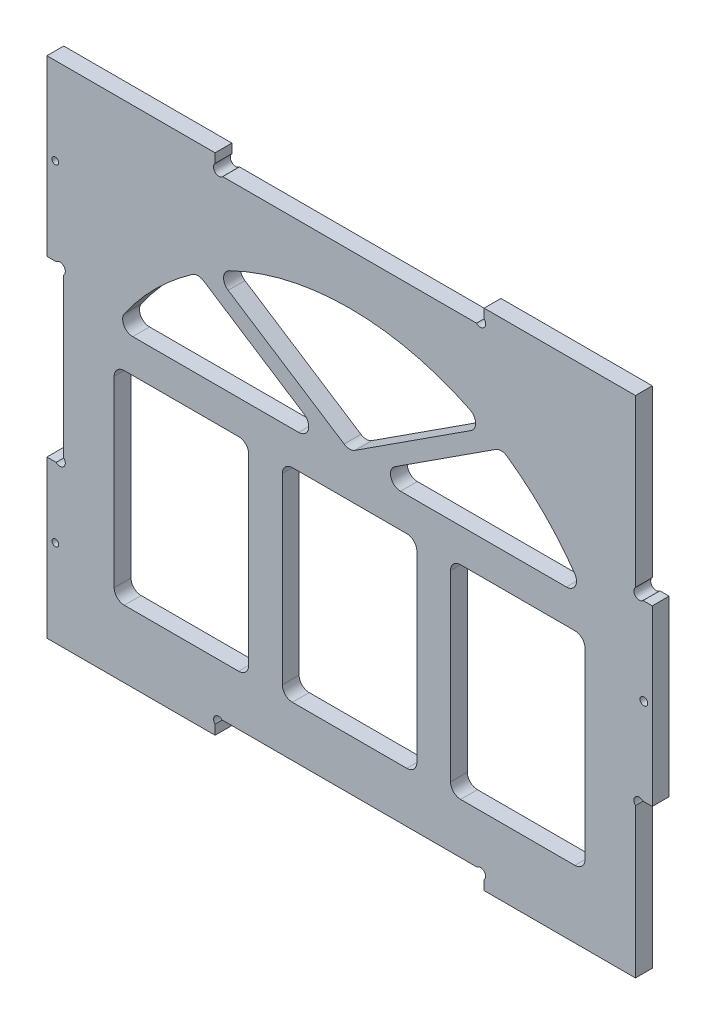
SolidWorks part; units mm, degrees
ref_plane "Plan de face" through (0, 0, 0) normal (0, 0, 1) x (1, 0, 0)
ref_plane "Plan de dessus" through (0, 0, 0) normal (0, 1, 0) x (1, 0, 0)
ref_plane "Plan de droite" through (0, 0, 0) normal (1, 0, 0) x (0, 0, -1)
sketch "Esquisse1" plane through (0, 0, 0) normal (0, 0, 1) x (1, 0, 0)
  line L0 (5, 145) -> (5, 0) construction
  line L1 (52.1213, 0) -> (127.8787, 0)
  line L2 (0, 0) -> (0, 145)
  line L3 (0, 145) -> (180, 145)
  line L4 (180, 0) -> (180, 145)
  line L5 (35, 145) -> (35, 0) construction
  line L6 (40, 145) -> (40, 0) construction
  line L7 (90, 145) -> (90, 0) construction
  line L8 (0, 100) -> (180, 100) construction
  line L9 (0, 105) -> (180, 105) construction
  line L10 (0, 140) -> (180, 140) construction
  line L11 (0, 0) -> (0, -5)
  line L12 (0, -5) -> (50, -5)
  line L13 (50, -5) -> (50, -2.1213)
  line L14 (130, 0) -> (118.0487, -11.9513) construction
  line L16 (175, -5) -> (130, -5)
  line L17 (130, -5) -> (130, -2.1213)
  line L18 (50, 0) -> (69.4165, -19.4165) construction
  line L19 (175, -5) -> (175, 0)
  line L20 (175, 0) -> (180, 0)
  arc A0 (130, -2.1213) -> (127.8787, 0) centre (128.9393, -1.0607) ccw
  arc A1 (52.1213, 0) -> (50, -2.1213) centre (51.0607, -1.0607) ccw
  dimension "D1" = 5
  dimension "D2" = 30
  dimension "D3" = 5
  dimension "D4" = 50
  dimension "D5" = 5
  dimension "D6" = 100
  dimension "D7" = 5
  dimension "D8" = 35
  dimension "D9" = 5
  dimension "D10" = 50
extrude "Boss.-Extru.1" add sketch "Esquisse1" along normal blind 5
sketch "Esquisse2" plane through (0, 0, 5) normal (0, 0, 1) x (1, 0, 0)
  line L0 (0, 145) -> (0, -5) construction
  line L1 (0, 93.3333) -> (5, 93.3333)
  line L2 (0, 93.3333) -> (0, 41.6667)
  line L3 (0, 41.6667) -> (5, 41.6667)
  line L4 (5, 93.3333) -> (5, 41.6667)
  line L5 (180, 145) -> (0, 145) construction
  line L6 (175, 145) -> (180, 145)
  line L7 (175, 145) -> (175, 93.3333)
  line L8 (175, 93.3333) -> (180, 93.3333)
  line L9 (180, 145) -> (180, 93.3333)
  line L10 (180, 0) -> (180, 145) construction
  line L11 (90, 145) -> (90, 112.4125) construction
  line L12 (180, -10) -> (175, -10)
  line L13 (180, -10) -> (180, 41.6667)
  line L14 (180, 41.6667) -> (175, 41.6667)
  line L15 (175, -10) -> (175, 41.6667)
  line L16 (50, 145) -> (130, 145)
  line L17 (50, 145) -> (50, 140)
  line L18 (50, 140) -> (130, 140)
  line L19 (130, 145) -> (130, 140)
  dimension "D1" = 5
  dimension "D2" = 5
  dimension "D3" = 5
  dimension "D4" = 80
extrude "Enlèv. mat.-Extru.1" cut sketch "Esquisse2" against normal through all
sketch "Esquisse3" plane through (0, 0, 5) normal (0, 0, 1) x (1, 0, 0)
  line L0 (50, 140) -> (58.6162, 148.6162) construction
  line L1 (130, 140) -> (116.999, 153.001) construction
  line L2 (5, 93.3333) -> (-9.1547, 79.1786) construction
  line L3 (5, 41.6667) -> (-9.901, 56.5676) construction
  line L4 (175, 93.3333) -> (188.31, 106.6433) construction
  line L5 (175, 41.6667) -> (184.3119, 32.3548) construction
  line L6 (50, 140) -> (130, 140) construction
  line L7 (5, 41.6667) -> (5, 93.3333) construction
  line L8 (175, 145) -> (175, 93.3333) construction
  line L9 (175, 41.6667) -> (175, -5) construction
  circle A0 centre (51.1314, 141.1314) radius 1.6
  circle A1 centre (128.8686, 141.1314) radius 1.6
  circle A2 centre (3.8686, 92.202) radius 1.6
  circle A3 centre (3.8686, 42.798) radius 1.6
  circle A4 centre (176.1314, 94.4647) radius 1.6
  circle A5 centre (176.1314, 40.5353) radius 1.6
  dimension "D1" = 3.2
  dimension "D2" = 45
  dimension "D3" = 45
  dimension "D4" = 45
  dimension "D5" = 45
  dimension "D6" = 45
  dimension "D7" = 45
extrude "Enlèv. mat.-Extru.2" cut sketch "Esquisse3" against normal through all
sketch "Esquisse5" plane through (0, 0, 5) normal (0, 0, 1) x (1, 0, 0)
  line L0 (180, 41.6667) -> (180, 93.3333) construction
  line L1 (177.5, 67.5) -> (191.6973, 67.5) construction
  line L2 (177.2627, 93.3333) -> (180, 93.3333) construction
  line L3 (180, 41.6667) -> (177.2627, 41.6667) construction
  circle A0 centre (177.5, 67.5) radius 1.15
  dimension "D2" = 2.3
  dimension "D1" = 2.5
extrude "Enlèv. mat.-Extru.3" cut sketch "Esquisse5" against normal through all
sketch "Esquisse6" plane through (0, 0, 5) normal (0, 0, 1) x (1, 0, 0)
  line L0 (5, 41.6667) -> (0, 0) construction
  line L1 (5, 93.3333) -> (0, 145) construction
  arc A0 (2.7373, 41.6667) -> (5, 43.9294) centre (3.8686, 42.798) ccw construction
  circle A1 centre (2.5, 20.8333) radius 1
  arc A2 (5, 91.0706) -> (2.7373, 93.3333) centre (3.8686, 92.202) ccw construction
  circle A3 centre (2.5, 119.1667) radius 1
extrude "Enlèv. mat.-Extru.4" cut sketch "Esquisse6" against normal blind 10
sketch "Esquisse7" plane through (0, 0, 5) normal (0, 0, 1) x (1, 0, 0)
  line L0 (20, 125) -> (160, 125) construction
  line L1 (160, 125) -> (160, 15) construction
  line L2 (160, 15) -> (20, 15) construction
  line L3 (20, 15) -> (20, 125) construction
  line L4 (5, 43.9294) -> (5, 91.0706) construction
  line L5 (175, -5) -> (175, 39.4039) construction
  line L6 (52.1213, 0) -> (127.8787, 0) construction
  line L7 (52.2627, 140) -> (127.7373, 140) construction
  line L8 (20, 85.4219) -> (160, 85.4219)
  line L9 (20, 15) -> (60, 15)
  line L10 (20, 15) -> (20, 75.4219)
  line L11 (20, 75.4219) -> (60, 75.4219)
  line L12 (60, 15) -> (60, 75.4219)
  line L13 (70, 75.4219) -> (110, 75.4219)
  line L14 (70, 75.4219) -> (70, 15)
  line L15 (70, 15) -> (110, 15)
  line L16 (110, 75.4219) -> (110, 15)
  line L17 (120, 15) -> (160, 15)
  line L18 (120, 15) -> (120, 75.4219)
  line L19 (120, 75.4219) -> (160, 75.4219)
  line L20 (160, 15) -> (160, 75.4219)
  line L21 (95, 85.4219) -> (135.116, 111.4118)
  line L22 (85, 85.4219) -> (44.884, 111.4118)
  line L23 (49.6026, 114.3124) -> (90, 88.1402)
  line L24 (90, 88.1402) -> (130.3974, 114.3124)
  arc A0 (20, 85.4219) -> (44.884, 111.4118) centre (90, 43.308) cw
  arc A1 (49.6026, 114.3124) -> (130.3974, 114.3124) centre (90, 43.308) cw
  arc A2 (135.116, 111.4118) -> (160, 85.4219) centre (90, 43.308) cw
  dimension "D1" = 15
  dimension "D2" = 15
  dimension "D3" = 15
  dimension "D4" = 15
  dimension "D5" = 10
  dimension "D6" = 10
  dimension "D7" = 40
  dimension "D8" = 40
  dimension "D9" = 10
  dimension "D10" = 10
  dimension "D11" = 10
  dimension "D12" = 5
  dimension "D13" = 65
  dimension "D14" = 65
  dimension "D15" = 5
  dimension "D16" = 0
  dimension "D17" = 70
extrude "Enlèv. mat.-Extru.8" cut sketch "Esquisse7" against normal blind 10 contours A0 L8 L22 | A1 L23 L24 | A2 L21 L8 | L17 L20 L19 L18 | L16 L13 L14 L15 | L9 L12 L11 L10
fillet "Congé1" radius 3 9 edges at (160, 85.4219, 2.5) (95, 85.4219, 2.5) (135.116, 111.4118, 2.5) (130.3974, 114.3124, 2.5) (90, 88.1402, 2.5) (49.6026, 114.3124, 2.5) (20, 85.4219, 2.5) (44.884, 111.4118, 2.5) (85, 85.4219, 2.5)
fillet "Congé2" radius 3 12 edges at (160, 75.4219, 2.5) (160, 15, 2.5) (120, 15, 2.5) (120, 75.4219, 2.5) (110, 75.4219, 2.5) (110, 15, 2.5) (70, 15, 2.5) (70, 75.4219, 2.5) (60, 15, 2.5) (20, 15, 2.5) (60, 75.4219, 2.5) (20, 75.4219, 2.5)
